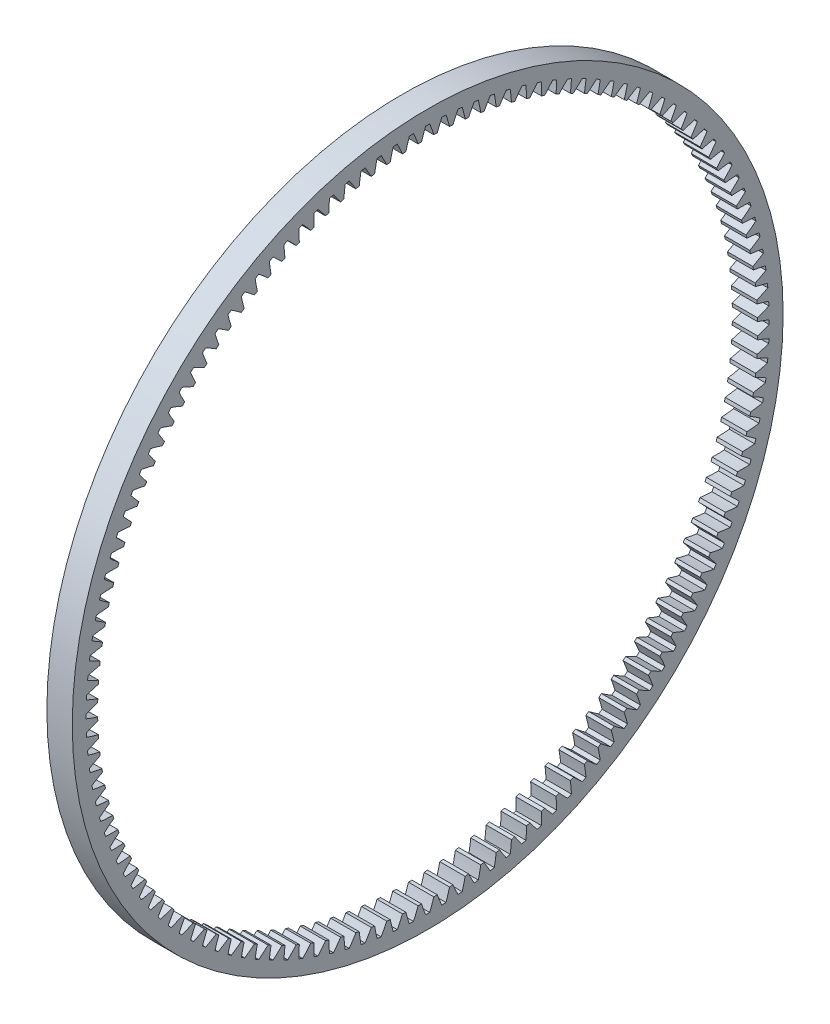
SolidWorks part; units mm, degrees
ref_plane "Plane1" through (0, 0, 0) normal (0, 0, 1) x (1, 0, 0)
ref_plane "Plane2" through (0, 0, 0) normal (0, 1, 0) x (1, 0, 0)
ref_plane "Plane3" through (0, 0, 0) normal (1, 0, 0) x (0, 0, -1)
other "Configuration Table"
sketch "HoldingSke" plane through (0, 0, 0) normal (0, 1, 0) x (1, 0, 0)
  line L0 (0, 0) -> (-0.223, -0.2477)
  line L1 (-15, 0) -> (100, 0) construction
  line L2 (0, 0) -> (-2.1039, 2.3779)
  line L3 (0, 0) -> (-11.863, 4.5341)
  line L4 (0, 0) -> (-5.7786, 6.4178)
  line L5 (0, 0) -> (-23.7986, -8.8762)
  line L6 (0, 0) -> (-10.5278, -7.1032)
  line L7 (-2.1039, 2.3779) -> (3.3635, 27.1825)
  line L8 (-76.2, 5.3779) -> (-54.61, 5.3779)
  line L9 (-71.009, 38.7566) -> (-53.1078, 45.2721)
  line L10 (-76.2, 71.12) -> (104.1128, 71.12)
  line L11 (0, 0) -> (-15, 0)
  line L12 (-76.2, 101.6) -> (-76.093, 101.6)
  line L13 (24.9733, 27.94) -> (52.9518, 28.4284)
  line L14 (24.9733, 27.94) -> (24.9743, 27.94)
  line L15 (24.9733, 27.94) -> (100.4006, 29.5858)
  circle A0 centre (0, 0) radius 210
  circle A1 centre (0, 0) radius 12.7
  circle A2 centre (0, 0) radius 12.7
sketch "BasProSke" plane through (0, 0, 0) normal (0, 1, 0) x (1, 0, 0)
  line L0 (-10, 0) -> (60, 0) construction
  line L1 (0, 195) -> (0, 210)
  line L2 (0, 195) -> (15, 195)
  line L3 (15, 195) -> (15, 210)
  line L4 (15, 210) -> (0, 210)
revolve "Base-Revolve" add sketch "BasProSke" angle 360 about L0
sketch "TooCutSke" plane through (0, 0, 0) normal (1, 0, 0) x (0, 0, -1)
  line L3 (2.6236, 197.9826) -> (2.6236, 53.6633) construction
  line L4 (0, 0) -> (0, 59.563) construction
  line L5 (0, 0) -> (-1.626, 68.3081) construction
  line L6 (-90.8394, 165.3383) -> (33.8471, 168.3064) construction
  circle A0 centre (0, 0) radius 198 construction
  circle A1 centre (0, 0) radius 201.751 construction
  circle A2 centre (0, 0) radius 167.4532 construction
  circle A3 centre (0, 0) radius 194.9746 construction
  arc A4 (3.6311, 194.9408) -> (1.2224, 201.7473) centre (-90.8394, 165.3383) ccw
  arc A5 (3.6311, 194.9408) -> (-3.6311, 194.9408) centre (0, 0) ccw
  arc A6 (1.2224, 201.7473) -> (-1.2224, 201.7473) centre (0, 0) ccw
  arc A7 (-1.2224, 201.7473) -> (-3.6311, 194.9408) centre (90.8394, 165.3383) ccw
extrude "ToothCut" cut sketch "TooCutSke" along normal through all
fillet "Breaks" [suppressed] radius 0.3
fillet "RootFillets" [suppressed] radius 0.751
pattern_circular "TeethCuts" count 132 every 2.727 about axis through (-10, 0, 0) along (1, 0, 0) of "ToothCut"
equation "' \"Module@HoldingSke\" = 6.35"
equation "' \"Num_teeth@HoldingSke\" = 24"
equation "' \"Ap@HoldingSke\" =  14.5"
equation "' \"Ap@HoldingSke\" = 14.5"
equation "' \"Width@HoldingSke\" = 12"
equation "' \"Diameter@HoldingSke\" = 8 * 25.4"
equation "' \"Show_teeth@HoldingSke\" = 100"
equation "' \"Backlash@HoldingSke\" = 0.009 * 25.4"
equation "' \"Addendum_fac@HoldingSke\" = 1.0"
equation "' \"Dedendum_fac@HoldingSke\" = 1.25"
equation "' \"Dedendum_add@HoldingSke\" = 0.00005 * 25.4"
equation "' \"Clearance_fac@HoldingSke\" = 0.25"
equation "\"Pitch@HoldingSke\" = 1 / \"Module@HoldingSke\" "
equation "\"Overcut_dia@TooCutSke\" = (\"Num_teeth@HoldingSke\" - 2 * \"Addendum_fac@HoldingSke\") / \"Pitch@HoldingSke\" - 0.002 * 25.4"
equation "\"Pitch_dia@TooCutSke\" = \"Num_teeth@HoldingSke\" / \"Pitch@HoldingSke\""
equation "\"Base_dia@TooCutSke\" = \"Num_teeth@HoldingSke\" / \"Pitch@HoldingSke\" * cos((\"Ap@HoldingSke\"  * 3.14159265 / 180)) * 0.90"
equation "\"Root_dia@TooCutSke\" = \"Num_teeth@HoldingSke\"  / \"Pitch@HoldingSke\" + 2 *  \"Dedendum_fac@HoldingSke\"/ \"Pitch@HoldingSke\" + \"Dedendum_add@HoldingSke\" * 2"
equation "\"Half_ang@TooCutSke\" = 180 / \"Num_teeth@HoldingSke\""
equation "\"Half_CT@TooCutSke\" = \"Num_teeth@HoldingSke\" / \"Pitch@HoldingSke\" * sin((3.14159265 / 2 / \"Num_teeth@HoldingSke\")) / 2 + 10 * \"Backlash@HoldingSke\" / 4"
equation "\"Flank_rad@TooCutSke\" = \"Num_teeth@HoldingSke\" / \"Pitch@HoldingSke\" / 4"
equation "\"Radius@RootFillets\"= \"Clearance_fac@HoldingSke\" / \"Pitch@HoldingSke\" + \"Dedendum_add@HoldingSke\""
equation "\"Break_rad@Breaks\" = 0.02 / \"Pitch@HoldingSke\" * 5"
equation "\"Num_teeth@TeethCuts\" = int( \"Show_teeth@HoldingSke\" ) + 1"
equation "\"Num_teeth@TeethCuts\" = ((sgn( \"Num_teeth@TeethCuts\" - \"Num_teeth@HoldingSke\" )-1)*( \"Num_teeth@TeethCuts\" - \"Num_teeth@HoldingSke\" ))/-2+ \"Num_teeth@HoldingSke\""
equation "\"Num_teeth@TeethCuts\" = ((sgn( \"Num_teeth@TeethCuts\" - 2.0)+1)*( \"Num_teeth@TeethCuts\" - 2.0))/2 +2.0"
equation "\"Angle@TeethCuts\" = 360.0 / \"Num_teeth@HoldingSke\""
equation "\"Diameter@BasProSke\" = \"Num_teeth@HoldingSke\"  / \"Pitch@HoldingSke\" + 2 *  \"Dedendum_fac@HoldingSke\"/ \"Pitch@HoldingSke\" + \"Dedendum_add@HoldingSke\" * 2 + 0.002 * 25.4"
equation "\"Diameter@BasProSke\" = ((sgn( \"Diameter@BasProSke\"  - \"Diameter@HoldingSke\" )+1)*( \"Diameter@BasProSke\"  - \"Diameter@HoldingSke\" ))/2 + \"Diameter@HoldingSke\""
equation "\"Inside_diameter@BasProSke\" =  (\"Num_teeth@HoldingSke\" - 2 * \"Addendum_fac@HoldingSke\") / \"Pitch@HoldingSke\" "
equation "\"Thickness@BasProSke\"  = \"Width@HoldingSke\""
